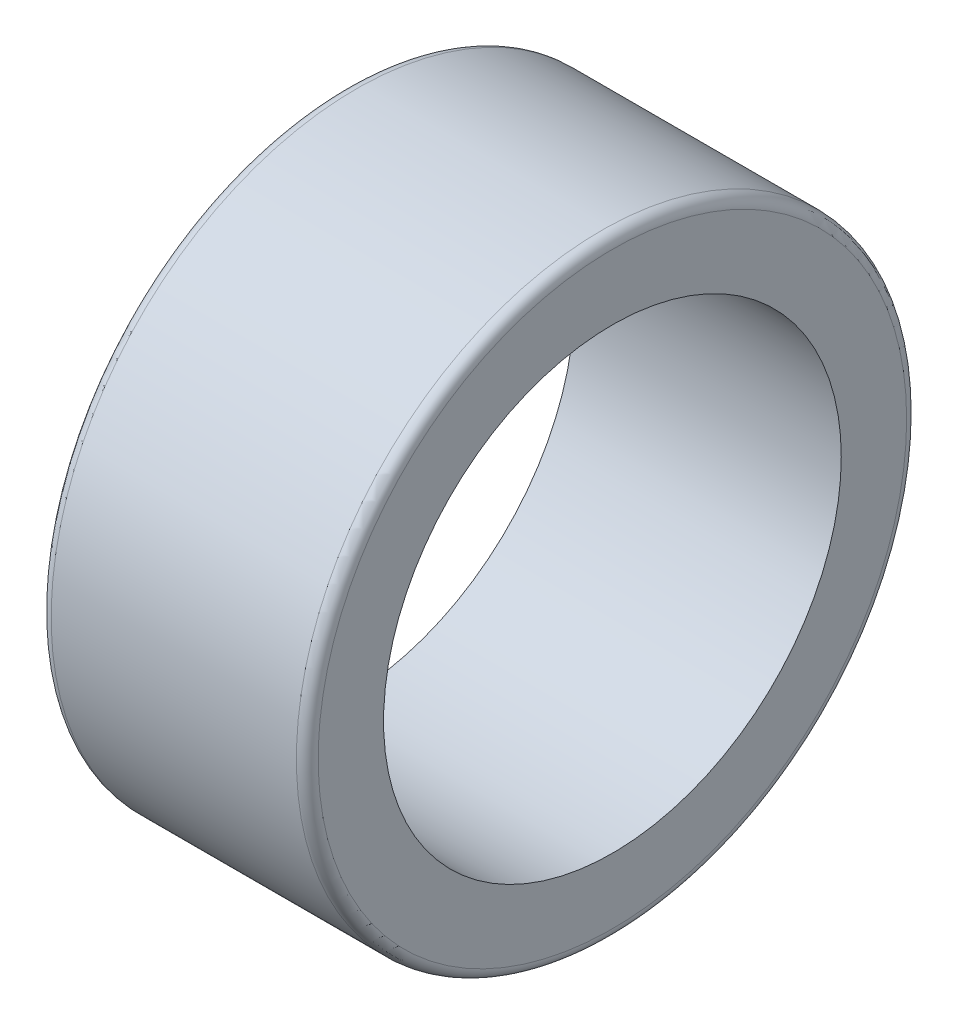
SolidWorks part; units mm, degrees
ref_plane "Plan de face" through (0, 0, 0) normal (0, 0, 1) x (1, 0, 0)
ref_plane "Plan de dessus" through (0, 0, 0) normal (0, 1, 0) x (1, 0, 0)
ref_plane "Plan de droite" through (0, 0, 0) normal (1, 0, 0) x (0, 0, -1)
sketch "Esquisse1" plane through (0, 0, 0) normal (0, 0, 1) x (1, 0, 0)
  line L0 (39.2883, 0) -> (-4.0669, 0) construction
  line L1 (31.0937, 21) -> (-4.0669, 21) construction
  line L2 (0, 32.3191) -> (0, -3.6972) construction
  line L4 (39.2883, 28) -> (-4.0669, 28) construction
  line L5 (24.5, 3.4532) -> (24.5, 32.3191) construction
  line L6 (1, 28) -> (23.5, 28)
  line L7 (0, 27) -> (0, 21)
  line L8 (0, 21) -> (24.5, 21)
  line L9 (24.5, 27) -> (24.5, 21)
  arc A0 (1, 28) -> (0, 27) centre (1, 27) ccw
  arc A1 (23.5, 28) -> (24.5, 27) centre (23.5, 27) cw
  point P17 (0, 28)
  dimension "D4" = 1
  dimension "D1" = 21
  dimension "D2" = 24.5
  dimension "D3" = 28
revolve "Révolution1" add sketch "Esquisse1" angle 360 about L0
